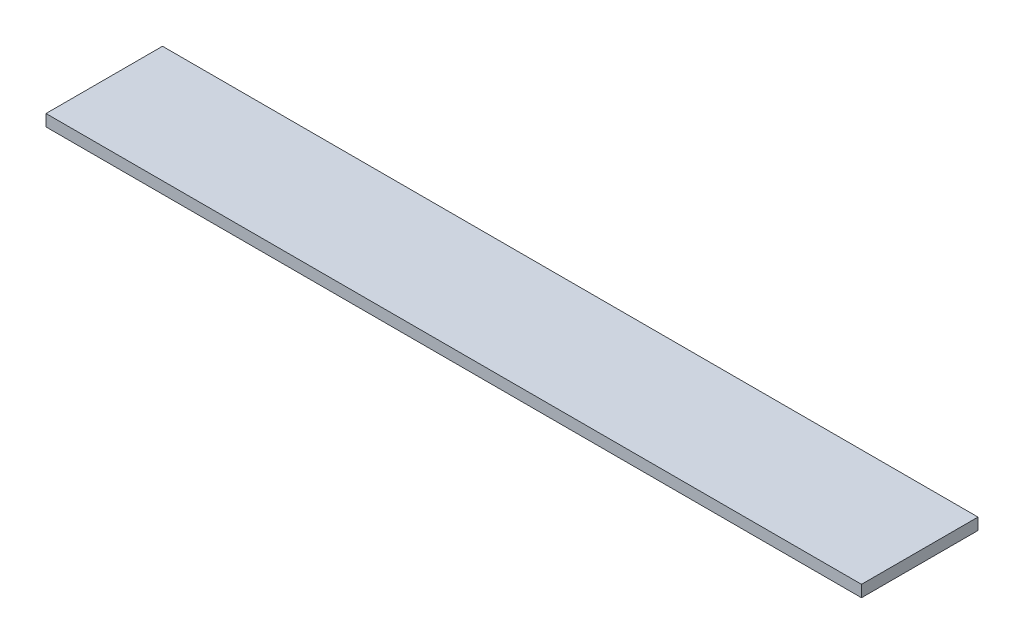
SolidWorks part; units mm, degrees
ref_plane "Front Plane" through (0, 0, 0) normal (0, 0, 1) x (1, 0, 0)
ref_plane "Top Plane" through (0, 0, 0) normal (0, 1, 0) x (1, 0, 0)
ref_plane "Right Plane" through (0, 0, 0) normal (1, 0, 0) x (0, 0, -1)
sketch "Sketch1" plane through (0, 0, 0) normal (0, 1, 0) x (1, 0, 0)
  line L0 (-3500, -500) -> (3500, 500) construction
  line L1 (-3500, 500) -> (3500, 500)
  line L2 (-3500, 500) -> (-3500, -500)
  line L3 (-3500, -500) -> (3500, -500)
  line L4 (3500, 500) -> (3500, -500)
  dimension "D1" = 1000
  dimension "D2" = 7000
extrude "Extrude1" add sketch "Sketch1" along normal blind 100
